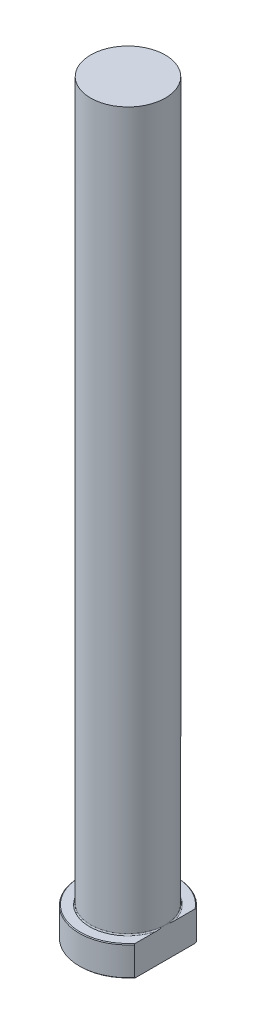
SolidWorks part; units mm, degrees
ref_plane "Front Plane" through (0, 0, 0) normal (0, 0, 1) x (1, 0, 0)
ref_plane "Top Plane" through (0, 0, 0) normal (0, 1, 0) x (1, 0, 0)
ref_plane "Right Plane" through (0, 0, 0) normal (1, 0, 0) x (0, 0, -1)
sketch "Sketch1" plane through (0, 0, 0) normal (0, 0, 1) x (1, 0, 0)
  line L0 (0, 259.9588) -> (0, -15.1925) construction
  line L1 (0, 0) -> (-13, 0)
  line L2 (-13, 0) -> (-13, 8)
  line L3 (-13, 8) -> (-10, 8)
  line L4 (-10, 8) -> (-10, 200)
  line L5 (-10, 200) -> (0, 200)
  line L6 (0, 200) -> (0, 0)
  dimension "L" = 200
  dimension "H" = 26
  dimension "T" = 8
  dimension "D" = 20
revolve "Revolve1" add sketch "Sketch1" angle 360 about L0
chamfer "Chamfer1" distance 0.2 angle 45 2 edges at (0, 8, 13) (0, 0, 13)
fillet "Fillet1" radius 0.3 1 edges at (0, 8, 10)
sketch "Sketch2" plane through (0, 0, 0) normal (0, 1, 0) x (1, 0, 0)
  line L0 (10, 8.3066) -> (10, -8.3066)
  circle A0 centre (0, 0) radius 13 construction
  arc A1 (10, -8.3066) -> (10, 8.3066) centre (0, 0) ccw
  circle A2 centre (0, 0) radius 10 construction
extrude "KEY" cut sketch "Sketch2" along normal through all
